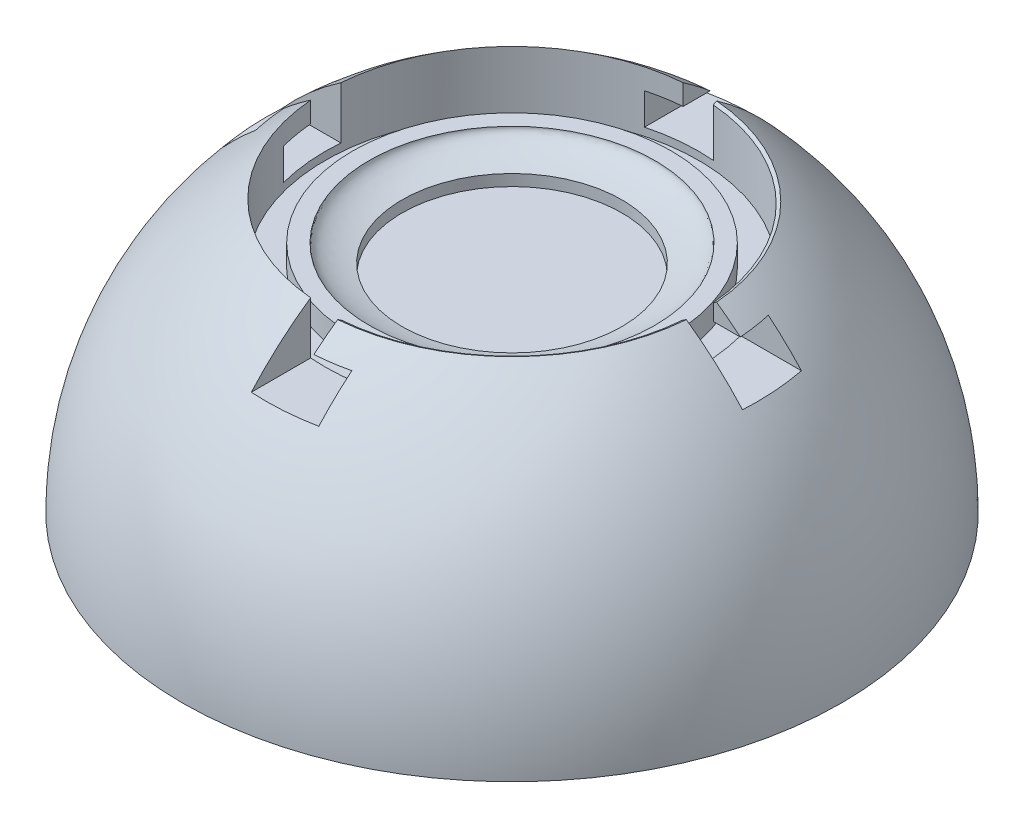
SolidWorks part; units mm, degrees
ref_plane "Front Plane" through (0, 0, 0) normal (0, 0, 1) x (1, 0, 0)
ref_plane "Top Plane" through (0, 0, 0) normal (0, 1, 0) x (1, 0, 0)
ref_plane "Right Plane" through (0, 0, 0) normal (1, 0, 0) x (0, 0, -1)
sketch "Sketch1" plane through (0, 0, 0) normal (0, 0, 1) x (1, 0, 0)
  line L0 (0, 6.1) -> (0, 7.5)
  line L1 (6.1, 0) -> (12, 0)
  line L2 (5.2, 8.5) -> (5.8, 8.5)
  line L3 (0, 12) -> (5.8, 12) construction
  line L4 (0, 9.5) -> (0, 8.5) construction
  line L5 (5.2, 8.5) -> (5.8, 8.5) construction
  line L6 (5.8, 12) -> (5.8, 8.5) construction
  line L7 (5.8, 12) -> (6.8, 12) construction
  line L8 (5.8, 12) -> (5.8, 7.7) construction
  line L9 (5.8, 7.7) -> (6.8, 7.7)
  line L10 (6.8, 12) -> (6.8, 7.7) construction
  line L11 (5.8, 8.5) -> (5.8, 7.7)
  line L12 (6.8, 7.7) -> (6.8, 9.8874)
  line L13 (0, 9.5) -> (0, 12) construction
  line L14 (0, 12) -> (0, 9.5) construction
  line L15 (0, 8.5) -> (5.2, 8.5) construction
  line L16 (0, 8.5) -> (5.2, 8.5) construction
  line L17 (0, 8.5) -> (0, 9.5) construction
  line L18 (0, 7.5) -> (0, 8.5) construction
  arc A1 (12, 0) -> (6.8, 9.8874) centre (0, 0) ccw
  arc A2 (6.1, 0) -> (0, 6.1) centre (0, 0) ccw
  arc A3 (4.677, 11.0511) -> (0, 12) centre (0, 0) ccw construction
  arc A4 (5.8, 10.5052) -> (4.677, 11.0511) centre (0, 0) ccw construction
  arc A5 (6.8, 9.8874) -> (5.8, 10.5052) centre (0, 0) ccw construction
  ellipse E0 centre (0, 8.5) end of major axis (5.2, 8.5) minor radius 1 (0, 9.5) -> (-1.3825, 9.464) ccw construction
  ellipse E1 centre (0, 11.8) end of major axis (5.5, 11.8) minor radius 1.4233 construction
  ellipse E2 centre (0, 8.5) end of major axis (5.2, 8.5) minor radius 1 (0.8821, 9.4855) -> (0, 9.5) ccw construction
  ellipse E3 centre (0, 8.5) end of major axis (5.2, 8.5) minor radius 1 (5.2, 8.5) -> (0.8821, 9.4855) ccw construction
  ellipse E4 centre (0, 8.5) end of major axis (5.2, 8.5) minor radius 1 (-1.3825, 9.464) -> (0, 7.5) ccw construction
  ellipse E5 centre (0, 8.5) end of major axis (5.2, 8.5) minor radius 1 (0, 7.5) -> (5.2, 8.5) ccw
  dimension "D1" = 12
  dimension "D2" = 6.1
  dimension "D3" = 1.4233
  dimension "D4" = 5.5
  dimension "D5" = 11.8
  dimension "D6" = 8.5
  dimension "D7" = 5.8
  dimension "D8" = 4.3
  dimension "D9" = 1
  dimension "D10" = 5.2
  dimension "D11" = 1
revolve "Revolve1" add sketch "Sketch1" angle 360 about L0
sketch "Sketch2" plane through (0, 0, 0) normal (0, -1, 0) x (1, 0, 0)
  circle A0 centre (0, 0) radius 7 construction
  circle A1 centre (7, 0) radius 0.25
  circle A2 centre (0, 7) radius 0.25
  circle A3 centre (-7, 0) radius 0.25
  circle A4 centre (0, -7) radius 0.25
  dimension "D1" = 0.5
  dimension "D2" = 0.5
  dimension "D3" = 0.5
  dimension "D4" = 0.5
  dimension "D5" = 14
sketch "Sketch4" plane through (0, 0, 0) normal (0, -1, 0) x (1, 0, 0)
  circle A0 centre (0, 0) radius 8 construction
  circle A1 centre (0, 8) radius 1.1
  circle A2 centre (8, 0) radius 1.1
  circle A3 centre (0, -8) radius 1.1
  circle A4 centre (-8, 0) radius 1.1
  dimension "D1" = 16
  dimension "D2" = 2.2
  dimension "D3" = 2.2
  dimension "D4" = 2.2
  dimension "D5" = 2.2
extrude "Cut-Extrude1" cut sketch "Sketch4" against normal blind 3
ref_plane "Plane1" through (0, 0, -12.5) normal (0, 0, 1) x (1, 0, 0)
sketch "Sketch5" plane through (0, 0, -12.5) normal (0, 0, 1) x (1, 0, 0)
  line L0 (6.8, 9.8874) -> (-6.8, 9.8874) construction
  line L1 (-0.55, 9.8874) -> (0.55, 9.8874)
  line L2 (-0.55, 9.8874) -> (-0.55, 9.1374)
  line L3 (-0.55, 7.9874) -> (0.55, 7.9874)
  line L4 (0.55, 9.8874) -> (0.55, 7.9874)
  line L5 (-0.55, 9.1374) -> (-0.55, 7.9874) construction
  line L6 (-0.55, 7.9874) -> (-1.75, 7.9874)
  line L7 (-0.55, 7.9874) -> (-0.55, 9.1374) construction
  line L8 (-0.55, 9.1374) -> (-1.75, 9.1374)
  line L9 (-1.75, 7.9874) -> (-1.75, 9.1374)
  point P6 (0, 9.8874)
  dimension "D1" = 1.1
  dimension "D2" = 1.9
  dimension "D3" = 1.15
  dimension "D4" = 1.2
extrude "Cut-Extrude2" cut sketch "Sketch5" along normal blind 6
pattern_circular "CirPattern1" count 4 over 360 about axis through (0, 0, 0) along (0, 1, 0) of "Cut-Extrude2"
chamfer "Chamfer1" distance 0.15 angle 60 2 edges at (4.8083, 9.8874, 4.8083) (4.8083, 9.8874, -4.8083)
chamfer "Chamfer3" distance 0.2 angle 45 1 edges at (6.1, 0, 0)
ref_plane "Plane2" through (0, 10.648, 0) normal (0, 1, 0) x (1, 0, 0)
sketch "Sketch6" plane through (0, 10.648, 0) normal (0, 1, 0) x (1, 0, 0)
  circle A0 centre (0, 0) radius 4
  dimension "D1" = 8
extrude "Cut-Extrude4" cut sketch "Sketch6" against normal blind 3.2
chamfer "Chamfer4" [suppressed] distance 0.3 angle 70
